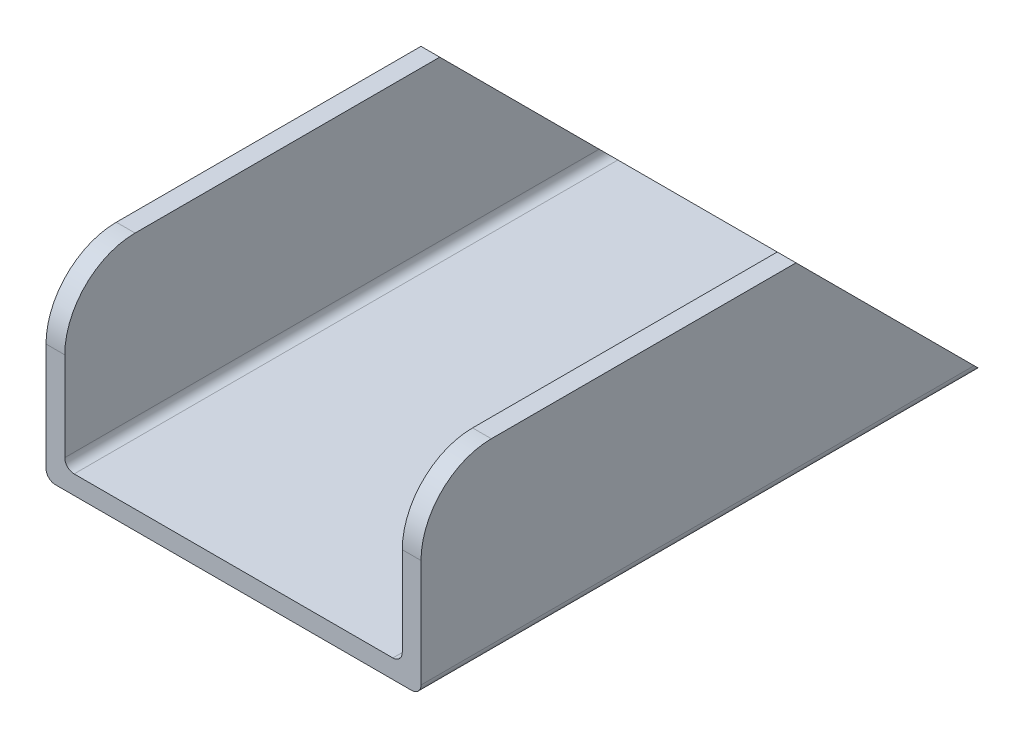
SolidWorks part; units mm, degrees
ref_plane "Plan de face" through (0, 0, 0) normal (0, 0, 1) x (1, 0, 0)
ref_plane "Plan de dessus" through (0, 0, 0) normal (0, 1, 0) x (1, 0, 0)
ref_plane "Plan de droite" through (0, 0, 0) normal (1, 0, 0) x (0, 0, -1)
sketch "Esquisse1" plane through (0, 0, 0) normal (0, 0, 1) x (1, 0, 0)
  line L0 (-38, 0) -> (38, 0)
  line L1 (40, 2) -> (40, 40)
  line L2 (40, 40) -> (36, 40)
  line L3 (36, 40) -> (36, 6)
  line L4 (34, 4) -> (-34, 4)
  line L5 (-36, 6) -> (-36, 40)
  line L6 (-36, 40) -> (-40, 40)
  line L7 (-40, 40) -> (-40, 2)
  arc A0 (-38, 0) -> (-40, 2) centre (-38, 2) cw
  arc A1 (38, 0) -> (40, 2) centre (38, 2) ccw
  arc A2 (36, 6) -> (34, 4) centre (34, 6) cw
  arc A3 (-34, 4) -> (-36, 6) centre (-34, 6) cw
  point P10 (-38, 40)
  point P13 (-40, 0)
  point P16 (40, 0)
  dimension "D8" = 2
  dimension "D1" = 40
  dimension "D2" = 40
  dimension "D3" = 4
  dimension "D4" = 4
  dimension "D5" = 4
  dimension "D6" = 40
  dimension "D7" = 40
extrude "Boss.-Extru.1" add sketch "Esquisse1" along normal blind 120
sketch "Esquisse2" plane through (-40, 0, 0) normal (-1, 0, 0) x (0, 0, 1)
  line L0 (0, 0) -> (40, 40)
  line L1 (120, 40) -> (0, 40) construction
  line L2 (0, 40) -> (0, 2) construction
  dimension "D1" = 45
extrude "Enlèv. mat.-Extru.1" cut sketch "Esquisse2" against normal through all and the other way through all
fillet "Congé1" radius 15 2 edges at (-38, 40, 120) (38, 40, 120)
